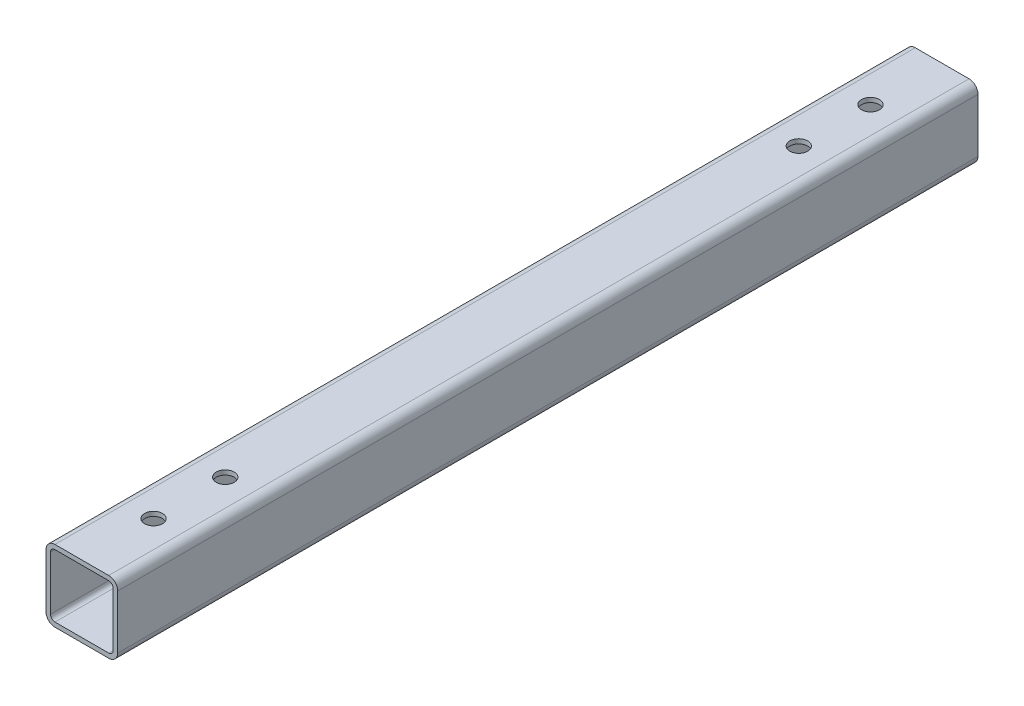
SolidWorks part; units mm, degrees
ref_plane "Front" through (0, 0, 0) normal (0, 0, 1) x (1, 0, 0)
ref_plane "Top" through (0, 0, 0) normal (0, 1, 0) x (1, 0, 0)
ref_plane "Right" through (0, 0, 0) normal (1, 0, 0) x (0, 0, -1)
sketch "Sketch1" plane through (0, 0, 0) normal (0, 0, 1) x (1, 0, 0)
  line L0 (-12.7, 12.7) -> (12.7, 12.7)
  line L1 (-12.7, 12.7) -> (-12.7, -12.7)
  line L2 (12.7, -12.7) -> (-12.7, -12.7)
  line L3 (12.7, -12.7) -> (12.7, 12.7)
  line L4 (-12.7, -12.7) -> (12.7, 12.7) construction
  dimension "square" = 25.4
extrude "Base-Extrude" add sketch "Sketch1" along normal mid plane 304.8
fillet "Fillet1" radius 3.175 4 edges at (-12.7, 12.7, 0) (12.7, 12.7, 0) (12.7, -12.7, 0) (-12.7, -12.7, 0)
shell "Shell1" thickness 1.5875
sketch "Sketch3" plane through (-12.7, 0, 0) normal (-1, 0, 0) x (0, 0, 1)
  line L0 (-152.4, 0) -> (-12.7, 0) construction
  line L1 (-152.4, 9.525) -> (-152.4, -9.525) construction
  circle A0 centre (-63.5, 0) radius 3.175
  circle A2 centre (-12.7, 0) radius 3.175
  dimension "D2" = 6.35
  dimension "D1" = 139.7
  dimension "D3" = 88.9
extrude "tank" [suppressed] cut sketch "Sketch3" against normal up to next
sketch "Sketch4" plane through (0, -12.7, 0) normal (0, -1, 0) x (1, 0, 0)
  line L4 (0, 152.4) -> (0, -152.4) construction
  line L7 (9.525, 152.4) -> (-9.525, 152.4) construction
  line L8 (9.525, -152.4) -> (-9.525, -152.4) construction
  circle A4 centre (0, 127) radius 3.175
  circle A5 centre (0, 101.6) radius 3.175
  circle A6 centre (0, -101.6) radius 3.175
  circle A7 centre (0, -127) radius 3.175
  dimension "D5" = 6.35
  dimension "D1" = 25.4
  dimension "D2" = 50.8
  dimension "D3" = 25.4
  dimension "D4" = 50.8
extrude "Cut-Extrude1" [suppressed] cut sketch "Sketch4" against normal through all
sketch "Sketch5" plane through (0, -12.7, 0) normal (0, -1, 0) x (1, 0, 0)
  line L0 (0, -152.4) -> (0, 152.4) construction
  line L1 (9.525, -152.4) -> (-9.525, -152.4) construction
  line L2 (9.525, 152.4) -> (-9.525, 152.4) construction
  circle A2 centre (0, 127) radius 3.175
  circle A3 centre (0, 101.6) radius 3.175
  circle A6 centre (0, -127) radius 3.175
  circle A7 centre (0, -101.6) radius 3.175
  dimension "D3" = 6.35
  dimension "D1" = 25.4
  dimension "D2" = 50.8
  dimension "D4" = 50.8
  dimension "D5" = 25.4
extrude "Cut-Extrude2" cut sketch "Sketch5" against normal through all
sketch "Sketch6" [suppressed] plane through (11.1125, 0, 0) normal (-1, 0, 0) x (0, 0, 1)
  line L0 (-298.45, 9.525) -> (-298.45, -9.525) construction
  line L1 (298.45, 9.525) -> (298.45, -9.525) construction
  line L2 (298.45, -12.7) -> (-298.45, -12.7) construction
  circle A2 centre (-95.25, 0) radius 2.5
  circle A3 centre (-222.25, 0) radius 2.5
  circle A6 centre (222.25, 0) radius 2.5
  circle A7 centre (95.25, 0) radius 2.5
  dimension "D1" = 76.2
  dimension "D2" = 127
  dimension "D3" = 127
  dimension "D4" = 76.2
  dimension "D5" = 12.7
extrude "Cut-Extrude3" [suppressed] cut sketch "Sketch6" against normal up to next
